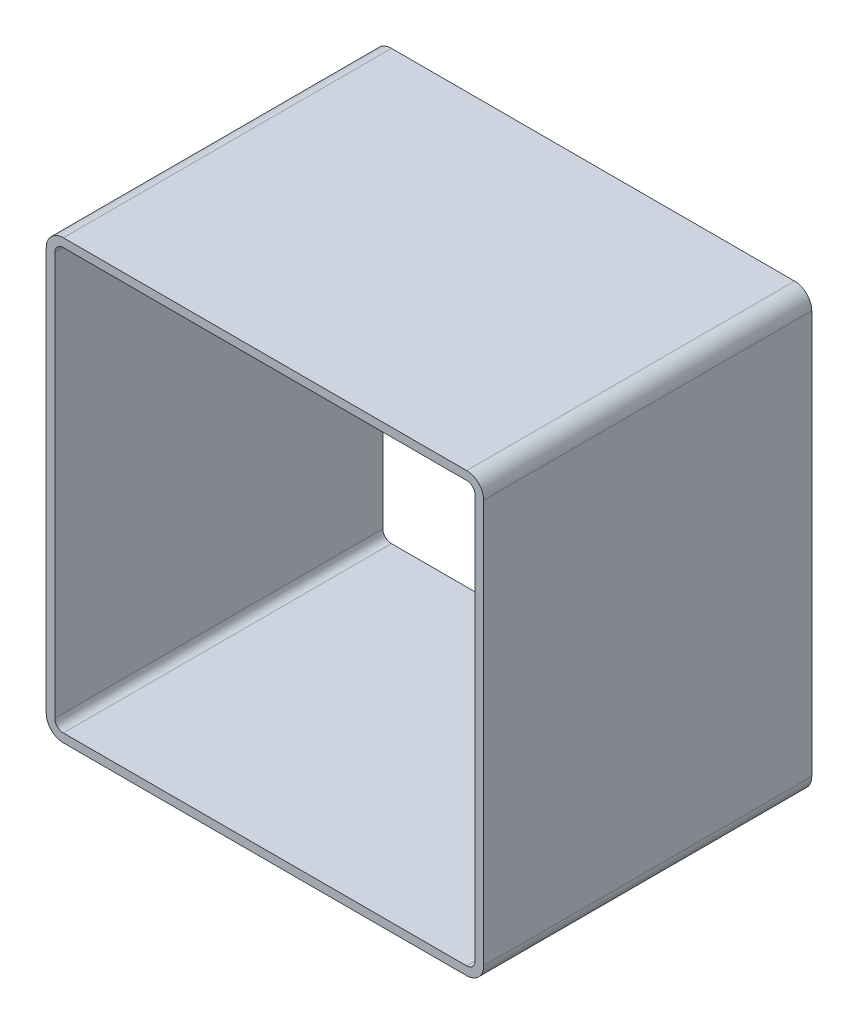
SolidWorks part; units mm, degrees
ref_plane "Front Plane" through (0, 0, 0) normal (0, 0, 1) x (1, 0, 0)
ref_plane "Top Plane" through (0, 0, 0) normal (0, 1, 0) x (1, 0, 0)
ref_plane "Right Plane" through (0, 0, 0) normal (1, 0, 0) x (0, 0, -1)
sketch "Sketch1" plane through (0, 0, 0) normal (0, 0, 1) x (1, 0, 0)
sketch_block_instance "HSS16x16x0.3125-1"
sketch_block "HSS16x16x0.3125"
extrude "Boss-Extrude1" add sketch "Sketch1" along normal blind 304.8
